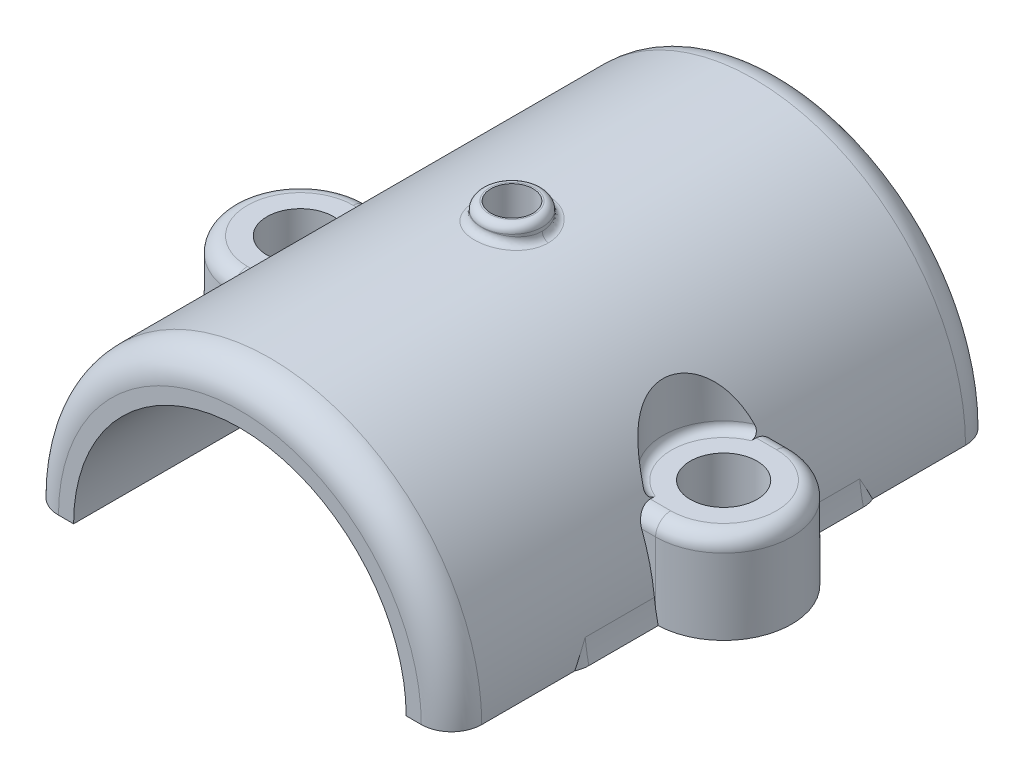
SolidWorks part; units mm, degrees
ref_plane "XY" through (0, 0, 0) normal (0, 0, 1) x (1, 0, 0)
ref_plane "YZ" through (0, 0, 0) normal (0, 1, 0) x (1, 0, 0)
ref_plane "XZ" through (0, 0, 0) normal (1, 0, 0) x (0, 0, -1)
imported_body "Imported1"
hole_wizard "Ø14.0 (14) Diameter Hole1" positions "Sketch2" profile "Sketch3" hole size "Ø14.0" standard "Ansi Metric"
sketch "Sketch2" plane through (0, -2.4015, 0) normal (0, 1, 0) x (-1, 0, 0)
  point P0 (-42.4688, -5.8387)
  point P1 (46.4312, -5.8387)
sketch "Sketch3" plane through (42.4688, -2.4015, -5.8387) normal (1, 0, 0) x (0, 0, 1)
  line L0 (0, 0) -> (0, 19.1898)
  line L1 (0, 19.1898) -> (7, 19.1898)
  line L2 (7, 19.1898) -> (7, 0)
  line L5 (7, 0) -> (0, 0)
  line L11 (0, -6.35) -> (0, 107.95) construction
  dimension "Thru Hole Dia." = 14
  dimension "Thru Hole Depth" = 19.1898
